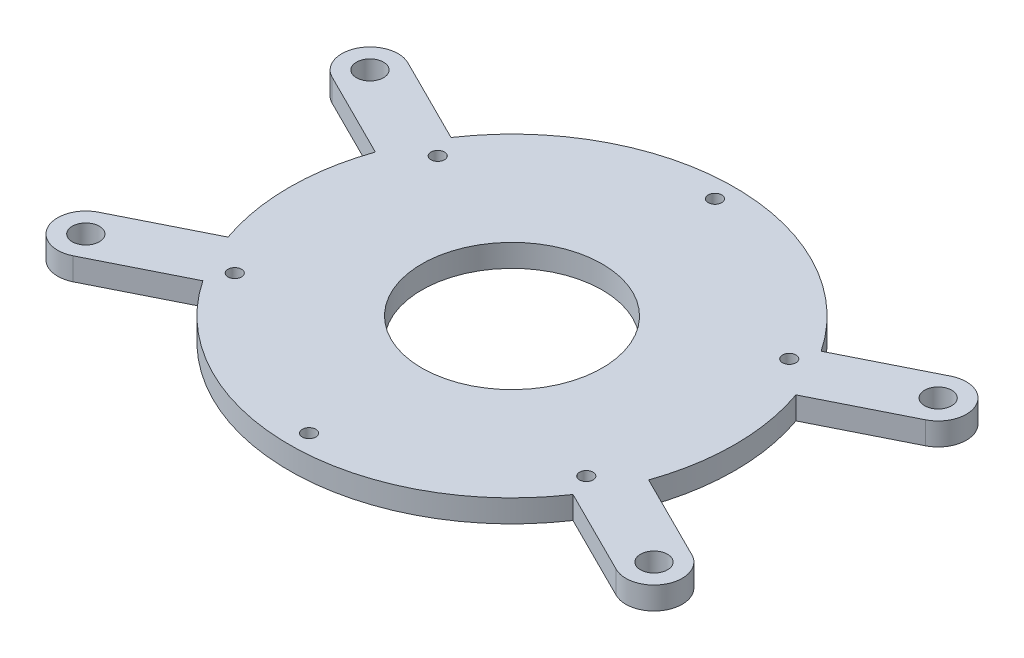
SolidWorks part; units mm, degrees
ref_plane "前视基准面" through (0, 0, 0) normal (0, 0, 1) x (1, 0, 0)
ref_plane "上视基准面" through (0, 0, 0) normal (0, 1, 0) x (1, 0, 0)
ref_plane "右视基准面" through (0, 0, 0) normal (1, 0, 0) x (0, 0, -1)
sketch "草图1" plane through (0, 0, 0) normal (0, 1, 0) x (1, 0, 0)
  line L0 (65.782, 25.9101) -> (46.6233, 16.3287)
  line L1 (60.1908, 37.0899) -> (41.0322, 27.5085)
  line L2 (0, 135.0816) -> (0, -134.5462) construction
  line L3 (161.8892, 80.9621) -> (-87.1466, -43.5827) construction
  line L7 (-65.782, 25.9101) -> (-46.6233, 16.3287)
  line L8 (-50, 21.5) -> (50, 21.5) construction
  line L9 (-50, 21.5) -> (-50, -21.5) construction
  line L10 (-50, -21.5) -> (50, -21.5) construction
  line L11 (50, 21.5) -> (50, -21.5) construction
  line L12 (-60.1908, 37.0899) -> (-41.0322, 27.5085)
  line L13 (-133.256, 0) -> (145.6129, 0) construction
  line L14 (65.782, -25.9101) -> (46.6233, -16.3287)
  line L15 (60.1908, -37.0899) -> (41.0322, -27.5085)
  line L16 (-65.782, -25.9101) -> (-46.6233, -16.3287)
  line L17 (-60.1908, -37.0899) -> (-41.0322, -27.5085)
  circle A0 centre (0, 0) radius 20
  circle A1 centre (0, 0) radius 49.4
  circle A2 centre (62.9864, 31.5) radius 6.25
  circle A6 centre (-62.9864, 31.5) radius 6.25
  circle A7 centre (62.9864, -31.5) radius 6.25
  circle A8 centre (-62.9864, -31.5) radius 6.25
  point P19 (0, 21.5)
  point P20 (50, 0)
  point P41 (0, 0)
  dimension "D2" = 12.5
  dimension "D5" = 98.8
  dimension "D7" = 40
  dimension "D1" = 63.43
  dimension "D3" = 100
  dimension "D4" = 43
  dimension "D6" = 10
extrude "凸台-拉伸1" add sketch "草图1" along normal blind 5 contours A1 A0 | L12 A6 L7 A1 | A8 L17 A1 L16 | A8 | L15 A7 L14 A1 | A7 | A2 | A2 L1 A1 L0
sketch "草图2" plane through (0, 5, 0) normal (0, 1, 0) x (1, 0, 0)
  line L0 (0, 78.1952) -> (0, -57.2274) construction
  line L1 (-93.9988, 0) -> (82.0699, 0) construction
  circle A0 centre (-62.9864, 31.5) radius 3
  arc A1 (-60.1908, 37.0899) -> (-65.782, 25.9101) centre (-62.9864, 31.5) ccw construction
  dimension "D1" = 6
extrude "切除-拉伸1" cut sketch "草图2" against normal up to next
mirror "镜向1" about plane through (0, 0, 0) normal (0, 0, 1) of "切除-拉伸1"
mirror "镜向2" about plane through (0, 0, 0) normal (1, 0, 0) of "镜向1", "切除-拉伸1"
sketch "草图3" plane through (0, 0, 0) normal (0, -1, 0) x (1, 0, 0)
  circle A0 centre (0, 45) radius 1.5
  dimension "D1" = 3
  dimension "D2" = 45
extrude "切除-拉伸2" cut sketch "草图3" against normal through all
pattern_circular "阵列(圆周)1" count 6 over 360 about axis through (0, 0, 0) along (0, 1, 0) of "切除-拉伸2"
